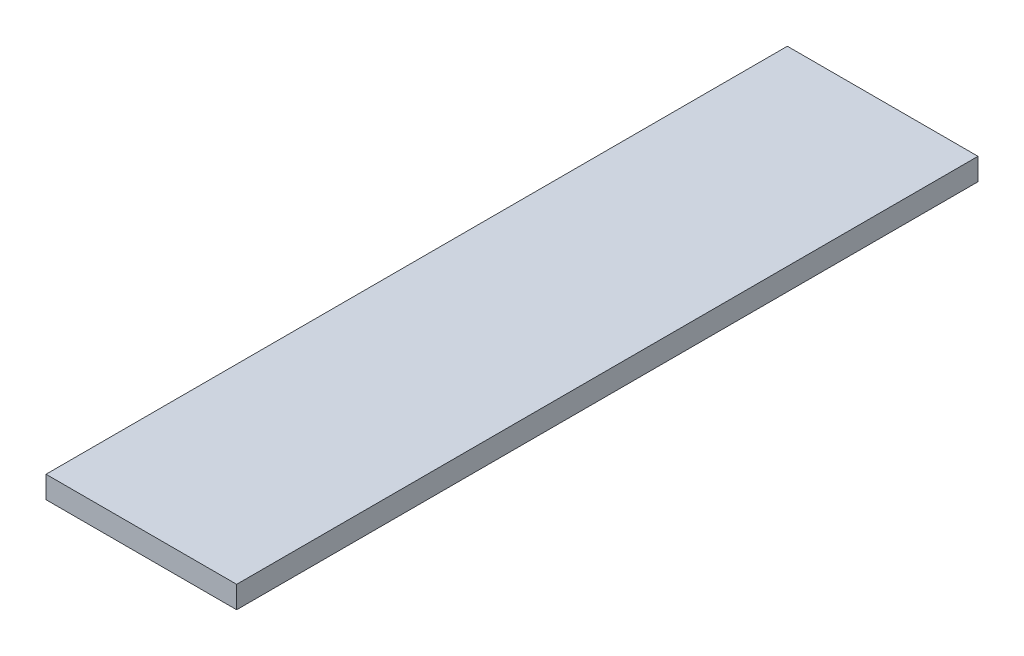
SolidWorks part; units mm, degrees
ref_plane "Front Plane" through (0, 0, 0) normal (0, 0, 1) x (1, 0, 0)
ref_plane "Top Plane" through (0, 0, 0) normal (0, 1, 0) x (1, 0, 0)
ref_plane "Right Plane" through (0, 0, 0) normal (1, 0, 0) x (0, 0, -1)
sketch "Sketch1" plane through (0, 0, 0) normal (0, 0, 1) x (1, 0, 0)
  line L7 (-30.861, -3.5719) -> (30.861, -3.5719)
  line L8 (-30.861, -3.5719) -> (-30.861, 3.5719)
  line L9 (-30.861, 3.5719) -> (30.861, 3.5719)
  line L10 (30.861, -3.5719) -> (30.861, 3.5719)
  line L11 (-30.861, -3.5719) -> (30.861, 3.5719) construction
  line L12 (-30.861, 3.5719) -> (30.861, -3.5719) construction
  point P4 (0, 0)
  point P14 (0, 0)
sketch "Sketch2" plane through (0, 0, 0) normal (0, 1, 0) x (0, 0, -1)
  line L0 (120, 30.861) -> (-120, 30.861) construction
  point P0 (-42.8475, 30.861)
  point P4 (0, 30.861)
  point P6 (42.8475, 30.861)
sketch "Sketch3" plane through (0, 0, 0) normal (0, 0, 1) x (1, 0, 0)
  line L6 (-30.861, 3.5719) -> (30.861, 3.5719)
  line L7 (30.861, 3.5719) -> (30.861, -3.5719)
  line L8 (30.861, -3.5719) -> (-30.861, -3.5719)
  line L9 (-30.861, -3.5719) -> (-30.861, 3.5719)
extrude "Boss-Extrude1" add sketch "Sketch3" along normal mid plane 240
equation "\"D1@Boss-Extrude1\" = \"Length@Sketch2\""
equation "\"D1@Sketch2\"=\"Width@Sketch1\" * 1.25"
equation "\"D2@Sketch2\"=\"D1@Sketch2\""
